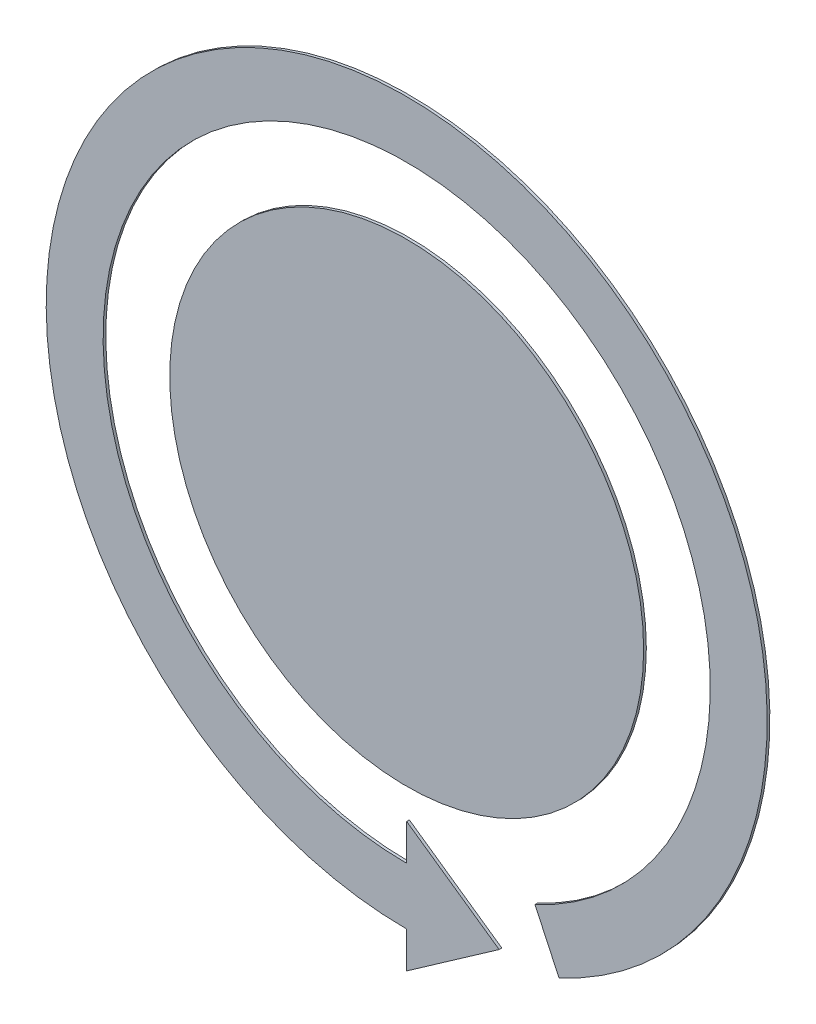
SolidWorks part; units mm, degrees
ref_plane "Ebene vorne" through (0, 0, 0) normal (0, 0, 1) x (1, 0, 0)
ref_plane "Ebene oben" through (0, 0, 0) normal (0, 1, 0) x (1, 0, 0)
ref_plane "Ebene rechts" through (0, 0, 0) normal (1, 0, 0) x (0, 0, -1)
sketch "Skizze1" plane through (0, 0, 0) normal (0, 0, 1) x (1, 0, 0)
  line L0 (169.9612, -364.483) -> (143.1284, -306.9398)
  line L1 (0, -338.6706) -> (0, -298.2026)
  line L2 (0, -298.2026) -> (103.1323, -370.4167)
  line L3 (103.1323, -370.4167) -> (0, -442.6305)
  line L4 (0, -442.6305) -> (0, -402.1625)
  line L5 (0, -298.2026) -> (0, 0) construction
  line L6 (143.1284, -306.9398) -> (0, 0) construction
  circle A0 centre (0, 0) radius 264.3492
  arc A1 (143.1284, -306.9398) -> (0, -338.6706) centre (0, 0) ccw
  arc A2 (169.9612, -364.483) -> (0, -402.1625) centre (0, 0) ccw
  arc A3 (65.452, -396.8006) -> (169.9612, -364.483) centre (0, 0) ccw construction
  arc A4 (52.0482, -334.6472) -> (143.1284, -306.9398) centre (0, 0) ccw construction
  arc A5 (0, -402.1625) -> (65.452, -396.8006) centre (0, 0) ccw construction
  arc A6 (0, -338.6706) -> (52.0482, -334.6472) centre (0, 0) ccw construction
  dimension "D1" = 804.325
  dimension "D2" = 677.3412
  dimension "D3" = 528.6985
  dimension "D4" = 125
  dimension "D5" = 125
  dimension "D6" = 40.468
  dimension "D7" = 25
extrude "Aufsatz-Linear austragen1" add sketch "Skizze1" along normal blind 3
